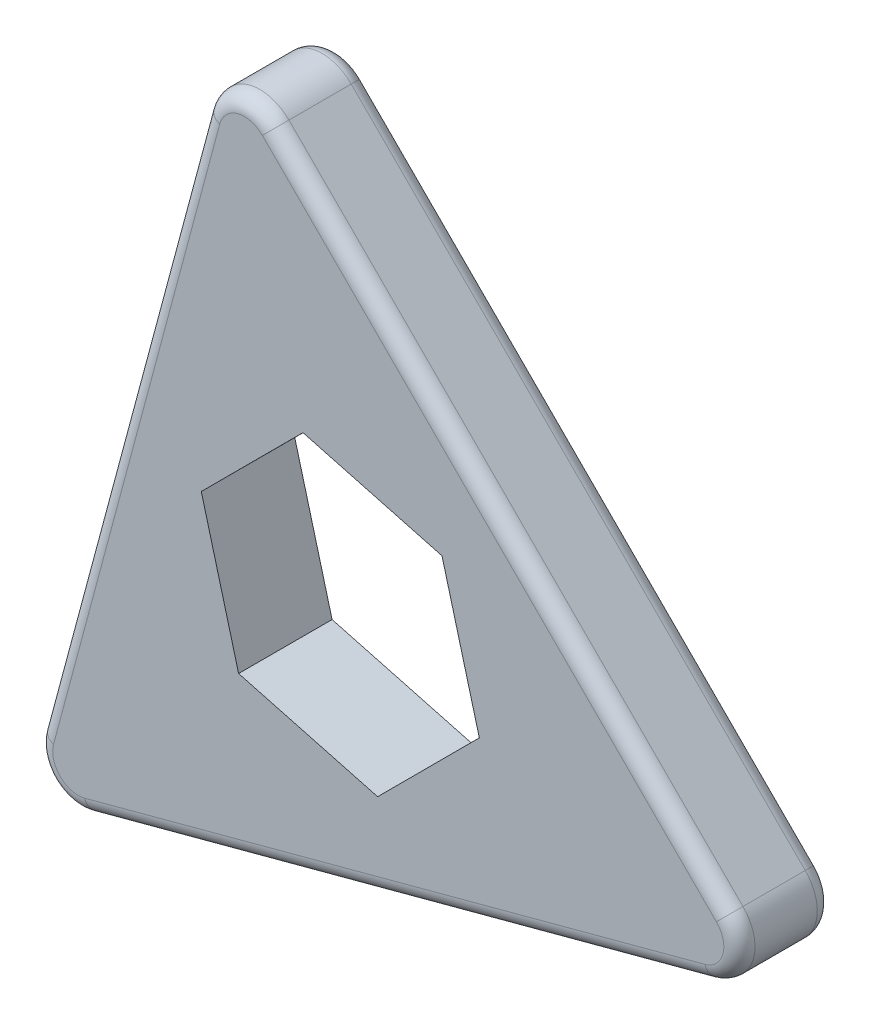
SolidWorks part; units mm, degrees
ref_plane "Plan1" through (0, 0, 0) normal (0, 0, 1) x (1, 0, 0)
ref_plane "Plan2" through (0, 0, 0) normal (0, 1, 0) x (1, 0, 0)
ref_plane "Plan3" through (0, 0, 0) normal (1, 0, 0) x (0, 0, -1)
sketch "Esquisse1" plane through (0, 0, 0) normal (0, 0, 1) x (1, 0, 0)
  line L0 (-2.1487, 12.4243) -> (12.4243, -2.1487)
  line L1 (-4.3513, 11.8341) -> (-9.6854, -8.073)
  line L2 (-8.073, -9.6854) -> (11.8341, -4.3513)
  line L15 (1.198, -4.4607) -> (4.4621, -1.1928)
  line L16 (4.4621, -1.1928) -> (3.2641, 3.2679)
  line L17 (3.2641, 3.2679) -> (-1.198, 4.4607)
  line L18 (-1.198, 4.4607) -> (-4.4621, 1.1928)
  line L19 (-4.4621, 1.1928) -> (-3.2641, -3.2679)
  line L20 (-3.2641, -3.2679) -> (1.198, -4.4607)
  line L123 (0, 0) -> (-3.0796, 11.4933) construction
  line L126 (1.198, -4.4607) -> (4.4621, -1.1928)
  line L127 (4.4621, -1.1928) -> (3.2641, 3.2679)
  line L128 (3.2641, 3.2679) -> (-1.198, 4.4607)
  line L129 (-1.198, 4.4607) -> (-4.4621, 1.1928)
  line L130 (-4.4621, 1.1928) -> (-3.2641, -3.2679)
  line L131 (-3.2641, -3.2679) -> (1.198, -4.4607)
  arc A2 (11.5881, -4.3927) -> (12.2319, -1.9898) centre (11.4933, -3.0796) ccw
  arc A3 (11.8341, -4.3513) -> (12.4243, -2.1487) centre (11.4933, -3.0796) ccw
  arc A5 (-9.5983, -7.8392) -> (-7.8392, -9.5983) centre (-8.4137, -8.4137) ccw
  arc A7 (-1.9898, 12.2319) -> (-4.3927, 11.5881) centre (-3.0796, 11.4933) ccw
  arc A8 (-2.1487, 12.4243) -> (-4.3513, 11.8341) centre (-3.0796, 11.4933) ccw
  arc A9 (-9.6854, -8.073) -> (-8.073, -9.6854) centre (-8.4137, -8.4137) ccw
  dimension "D1" = 0.25
  dimension "D2" = 0.25
  dimension "D3" = 0.25
  dimension "D4" = 0
extrude "Base-Extrusion" add sketch "Esquisse1" along normal blind 3
fillet "Congé1" radius 0.5
